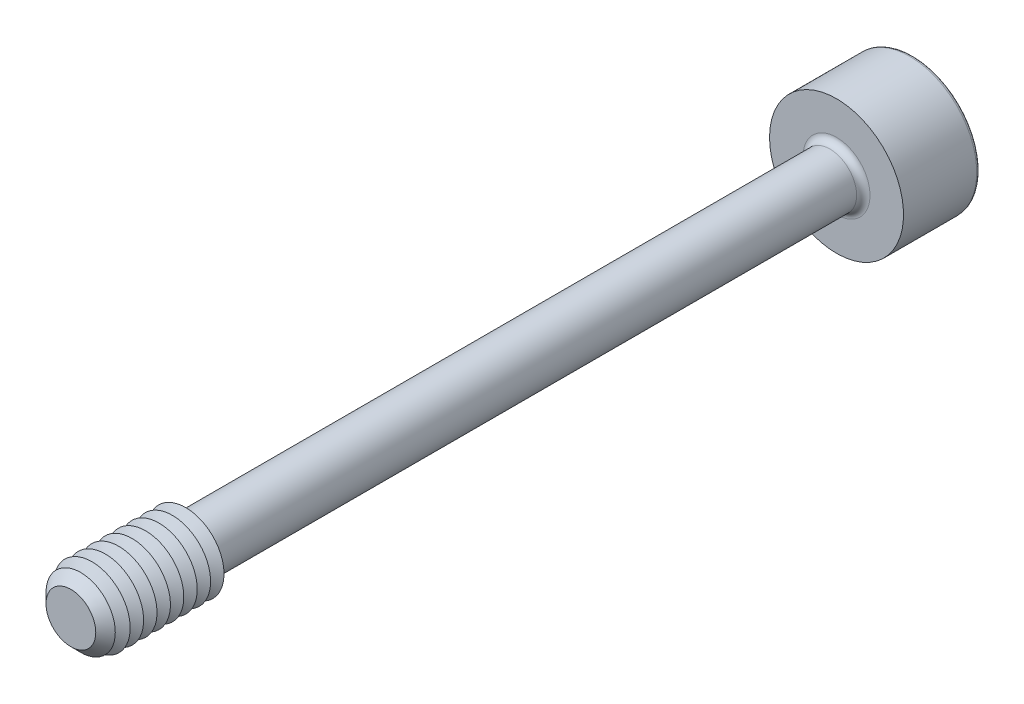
SolidWorks part; units mm, degrees
ref_plane "Front Plane" through (0, 0, 0) normal (0, 0, 1) x (1, 0, 0)
ref_plane "Top Plane" through (0, 0, 0) normal (0, 1, 0) x (1, 0, 0)
ref_plane "Right Plane" through (0, 0, 0) normal (1, 0, 0) x (0, 0, -1)
sketch "Sketch1" plane through (0, 0, 0) normal (0, 0, 1) x (1, 0, 0)
  circle A0 centre (0, 0) radius 1.4
  dimension "D1" = 2.8
extrude "Extrude1" add sketch "Sketch1" along normal mid plane 40
sketch "Sketch2" plane through (0, 0, 0) normal (1, 0, 0) x (0, 0, -1)
  line L0 (-20, 0) -> (-20, 2)
  line L1 (-20, 1.4) -> (-20, -1.4) construction
  line L2 (-20, 2) -> (-14, 2)
  line L3 (-14, 2) -> (-13.6536, 1.4)
  line L4 (20, 1.4) -> (-20, 1.4) construction
  line L5 (-13.6536, 1.4) -> (-13.6536, 0)
  line L6 (-13.6536, 0) -> (-20, 0)
  dimension "D1" = 2
  dimension "D2" = 120
  dimension "D3" = 6
revolve "Revolve1" add sketch "Sketch2" angle 360 about L6
chamfer "Chamfer1" distance 0.7 angle 45 1 edges at (0, 2, 20)
sketch "Sketch3" plane through (0, 0, -20) normal (0, 0, -1) x (-1, 0, 0)
  circle A0 centre (0, 0) radius 3.5
  dimension "D1" = 7
extrude "Extrude2" add sketch "Sketch3" along normal blind 4
sketch "Sketch4" plane through (-13.7, 0, -24) normal (0, 0, 1) x (1, 0, 0)
  line L2 (12.834, -1.5) -> (14.566, -1.5)
  line L3 (14.566, -1.5) -> (15.4321, 0)
  line L4 (15.4321, 0) -> (14.566, 1.5)
  line L6 (14.566, 1.5) -> (12.834, 1.5)
  line L7 (12.834, 1.5) -> (11.9679, 0)
  line L8 (11.9679, 0) -> (12.834, -1.5)
  circle A0 centre (13.7, 0) radius 1.5 construction
  dimension "D1" = 3
extrude "Extrude3" cut sketch "Sketch4" along normal blind 3
fillet "Fillet1" radius 0.35 1 edges at (-1.4, 0, -20)
fillet "Fillet2" radius 0.175 1 edges at (-3.5, 0, -24)
sketch "Sketch5" plane through (0, 0, 0) normal (1, 0, 0) x (0, 0, -1)
  line L0 (21, 0) -> (21, -1.5)
  line L1 (21, -1.5) -> (20.134, 0)
  line L2 (20.134, 0) -> (21, 0)
  dimension "D1" = 30
revolve "Cut-Revolve1" cut sketch "Sketch5" angle 360 about L2
sketch "Sketch6" plane through (0, 0, 0) normal (1, 0, 0) x (0, 0, -1)
  line L0 (1.332, 0) -> (-13.289, 0) construction
sketch "Sketch7" plane through (0, 0, 0) normal (1, 0, 0) x (0, 0, -1)
  line L0 (-14, 2) -> (-14.35, 1.3938)
  line L1 (-14.35, 1.3938) -> (-14.7, 2)
  line L2 (-14, 2) -> (-19.3, 2) construction
  line L3 (-14.7, 2) -> (-14, 2)
  dimension "D1" = 0.7
revolve "Cut-Revolve2" cut sketch "Sketch7" angle 360 about L0
pattern_linear "LPattern1" count 8 spacing 0.7 along (0, 0, 1) of "Cut-Revolve2"
